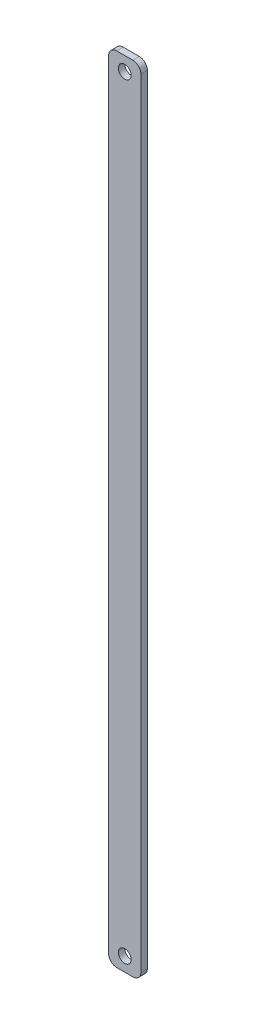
SolidWorks part; units mm, degrees
ref_plane "Front Plane" through (0, 0, 0) normal (0, 0, 1) x (1, 0, 0)
ref_plane "Top Plane" through (0, 0, 0) normal (0, 1, 0) x (1, 0, 0)
ref_plane "Right Plane" through (0, 0, 0) normal (1, 0, 0) x (0, 0, -1)
sketch "Sketch1" plane through (0, 0, 0) normal (0, 1, 0) x (1, 0, 0)
  line L1 (-4.035, -0.815) -> (4.035, -0.815)
  line L2 (-4.035, -0.815) -> (-4.035, 0.815)
  line L3 (-4.035, 0.815) -> (4.035, 0.815)
  line L4 (4.035, -0.815) -> (4.035, 0.815)
  line L5 (-4.035, -0.815) -> (4.035, 0.815) construction
  line L6 (-4.035, 0.815) -> (4.035, -0.815) construction
  point P0 (0, 0)
  dimension "D1" = 8.07
  dimension "D2" = 1.63
extrude "Boss-Extrude1" add sketch "Sketch1" along normal blind 198.37
sketch "Sketch2" plane through (0, 0, 0.815) normal (0, 0, 1) x (1, 0, 0)
  line L0 (-4.035, 198.37) -> (-4.035, 0) construction
  line L1 (-4.035, 198.37) -> (4.035, 198.37) construction
  line L3 (4.035, 198.37) -> (4.035, 0) construction
  circle A0 centre (-0.005, 3.5) radius 1.6
  circle A1 centre (0.005, 194.87) radius 1.6
extrude "Cut-Extrude1" cut sketch "Sketch2" against normal up to surface (1.63 mm away)
fillet "Fillet1" radius 2 4 edges at (-4.035, 0, 0) (4.035, 0, 0) (-4.035, 198.37, 0) (4.035, 198.37, 0)
equation "\"D6@Sketch2\"=\"D3@Sketch2\""
equation "\"D4@Sketch2\"=\"D2@Sketch2\""
